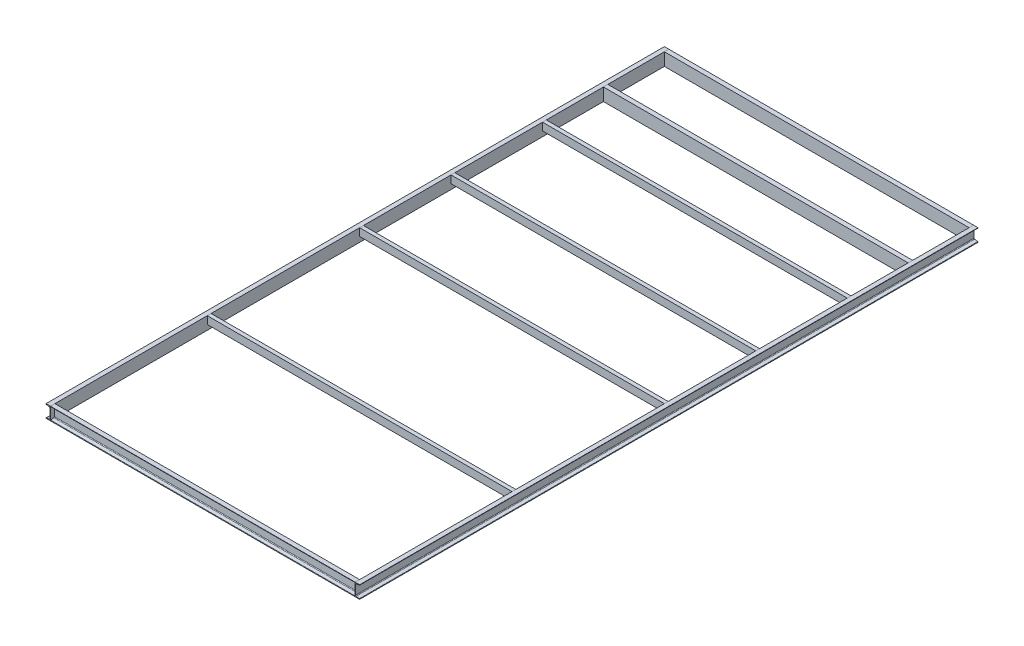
SolidWorks part; units mm, degrees
ref_plane "Front Plane" through (0, 0, 0) normal (0, 0, 1) x (1, 0, 0)
ref_plane "Top Plane" through (0, 0, 0) normal (0, 1, 0) x (1, 0, 0)
ref_plane "Right Plane" through (0, 0, 0) normal (1, 0, 0) x (0, 0, -1)
sketch3d "3DSketch1"
  line L0 (0, 0, -1524) -> (3048, 0, -1524)
  line L1 (0, 0, 0) -> (0, 0, -6096)
  line L2 (0, 0, 0) -> (3048, 0, 0)
  line L3 (3048, 0, 0) -> (3048, 0, -6096)
  line L4 (0, 0, -6096) -> (3048, 0, -6096)
  line L5 (0, 0, -3048) -> (3048, 0, -3048)
  line L6 (0, 0, -5486.4) -> (3048, 0, -5486.4)
  line L7 (0, 0, -4876.8) -> (3048, 0, -4876.8)
  line L8 (0, 0, -3962.4) -> (3048, 0, -3962.4)
  dimension "D1" = 3048
  dimension "D2" = 6096
  dimension "D3" = 1524
  dimension "D4" = 609.6
  dimension "D5" = 609.6
  dimension "D6" = 914.4
other "Structural Member2"
ref_plane "Plane2" through (0, 0, 0) normal (0, 0, -1) x (-1, 0, 0)
sketch "Sketch11" plane through (0, -63.5, 0) normal (0, 0, -1) x (-1, 0, 0)
  line L0 (0, -63.5) -> (0, 63.5)
  line L1 (0, 63.5) -> (44.45, 63.5)
  line L2 (0, -63.5) -> (44.45, -63.5)
  line L6 (0, 0) -> (4.826, 0) construction
  line L12 (4.826, 45.8301) -> (4.826, -45.8301)
  line L15 (44.45, 63.5) -> (44.45, 61.0413)
  line L16 (44.45, -63.5) -> (44.45, -61.0413)
  line L17 (10.981, 53.0959) -> (42.1154, 58.2853)
  line L18 (10.981, -53.0959) -> (42.1154, -58.2853)
  arc A9 (4.826, -45.8301) -> (10.981, -53.0959) centre (12.192, -45.8301) ccw
  arc A10 (4.826, 45.8301) -> (10.981, 53.0959) centre (12.192, 45.8301) cw
  arc A11 (44.45, 61.0413) -> (42.1154, 58.2853) centre (41.656, 61.0413) cw
  arc A12 (44.45, -61.0413) -> (42.1154, -58.2853) centre (41.656, -61.0413) ccw
  point P4 (44.45, 58.6744)
  point P5 (44.45, -58.6744)
  point P6 (2.413, 0)
  point P7 (22.225, 63.5)
  point P8 (0, 0)
  point P12 (22.225, -63.5)
  dimension "RI" = 7.366
  dimension "D2" = 9.463
  dimension "RA" = 2.794
  dimension "Depth" = 127
  dimension "BF" = 44.45
  dimension "TW" = 4.826
  dimension "flange" = 2.4587
other "Structural Member3"
ref_plane "Plane4" through (0, 0, -1524) normal (1, 0, 0) x (0, 0, -1)
sketch "Sketch1" plane through (0, -38.1, -1524) normal (1, 0, 0) x (0, 0, -1)
  line L0 (0, -38.1) -> (0, 38.1)
  line L1 (0, 38.1) -> (38.0492, 38.1)
  line L2 (0, -38.1) -> (38.0492, -38.1)
  line L5 (31.75, -31.1658) -> (6.35, -31.1658) construction
  line L6 (0, 0) -> (6.5532, 0) construction
  line L12 (6.5532, 22.7314) -> (6.5532, -22.7314)
  line L15 (38.0492, 38.1) -> (38.0492, 35.9423)
  line L16 (38.0492, -38.1) -> (38.0492, -35.9423)
  line L17 (12.2837, 29.4961) -> (35.9268, 33.4369)
  line L18 (12.2837, -29.4961) -> (35.9268, -33.4369)
  arc A9 (6.5532, -22.7314) -> (12.2837, -29.4961) centre (13.4112, -22.7314) ccw
  arc A10 (6.5532, 22.7314) -> (12.2837, 29.4961) centre (13.4112, 22.7314) cw
  arc A11 (38.0492, 35.9423) -> (35.9268, 33.4369) centre (35.5092, 35.9423) cw
  arc A12 (38.0492, -35.9423) -> (35.9268, -33.4369) centre (35.5092, -35.9423) ccw
  point P4 (38.0492, 33.7907)
  point P5 (38.0492, -33.7907)
  point P6 (3.2766, 0)
  point P7 (19.0246, 38.1)
  point P12 (19.0246, -38.1)
  point P13 (0, 0)
  dimension "RI" = 6.858
  dimension "D2" = 9.463
  dimension "RA" = 2.54
  dimension "Depth" = 76.2
  dimension "BF" = 38.0492
  dimension "TW" = 6.5532
  dimension "flange" = 2.1577
  dimension "TF" = 6.9342
delete or keep bodies "Body-Delete1" type delete bodies bodies 111
other "Structural Member4"
ref_plane "Plane5" through (0, 0, -5486.4) normal (1, 0, 0) x (0, 0, -1)
sketch "Sketch13" plane through (0, -63.5, -5486.4) normal (1, 0, 0) x (0, 0, -1)
  line L0 (0, -63.5) -> (0, 63.5)
  line L1 (0, 63.5) -> (44.45, 63.5)
  line L2 (0, -63.5) -> (44.45, -63.5)
  line L6 (0, 0) -> (4.826, 0) construction
  line L12 (4.826, 45.8301) -> (4.826, -45.8301)
  line L15 (44.45, 63.5) -> (44.45, 61.0413)
  line L16 (44.45, -63.5) -> (44.45, -61.0413)
  line L17 (10.981, 53.0959) -> (42.1154, 58.2853)
  line L18 (10.981, -53.0959) -> (42.1154, -58.2853)
  arc A9 (4.826, -45.8301) -> (10.981, -53.0959) centre (12.192, -45.8301) ccw
  arc A10 (4.826, 45.8301) -> (10.981, 53.0959) centre (12.192, 45.8301) cw
  arc A11 (44.45, 61.0413) -> (42.1154, 58.2853) centre (41.656, 61.0413) cw
  arc A12 (44.45, -61.0413) -> (42.1154, -58.2853) centre (41.656, -61.0413) ccw
  point P4 (44.45, 58.6744)
  point P5 (44.45, -58.6744)
  point P6 (2.413, 0)
  point P7 (22.225, 63.5)
  point P8 (0, 0)
  point P12 (22.225, -63.5)
  dimension "RI" = 7.366
  dimension "D2" = 9.463
  dimension "RA" = 2.794
  dimension "Depth" = 127
  dimension "BF" = 44.45
  dimension "TW" = 4.826
  dimension "flange" = 2.4587
